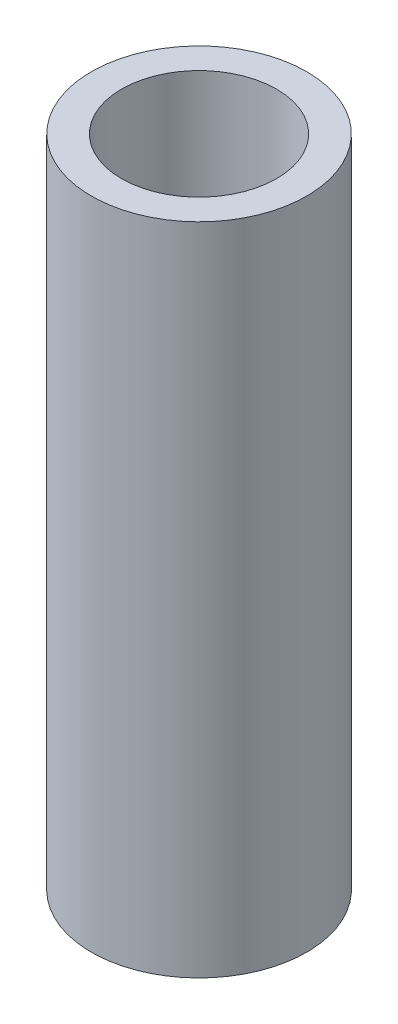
SolidWorks part; units mm, degrees
ref_plane "Front Plane" through (0, 0, 0) normal (0, 0, 1) x (1, 0, 0)
ref_plane "Top Plane" through (0, 0, 0) normal (0, 1, 0) x (1, 0, 0)
ref_plane "Right Plane" through (0, 0, 0) normal (1, 0, 0) x (0, 0, -1)
sketch "Sketch1" plane through (0, 0, 0) normal (0, 1, 0) x (1, 0, 0)
  circle A0 centre (0, 0) radius 3.175
  circle A1 centre (0, 0) radius 2.286
  dimension "D1" = 0.889
  dimension "D2" = 6.35
extrude "Boss-Extrude1" add sketch "Sketch1" along normal up to surface (19.304 mm away)
